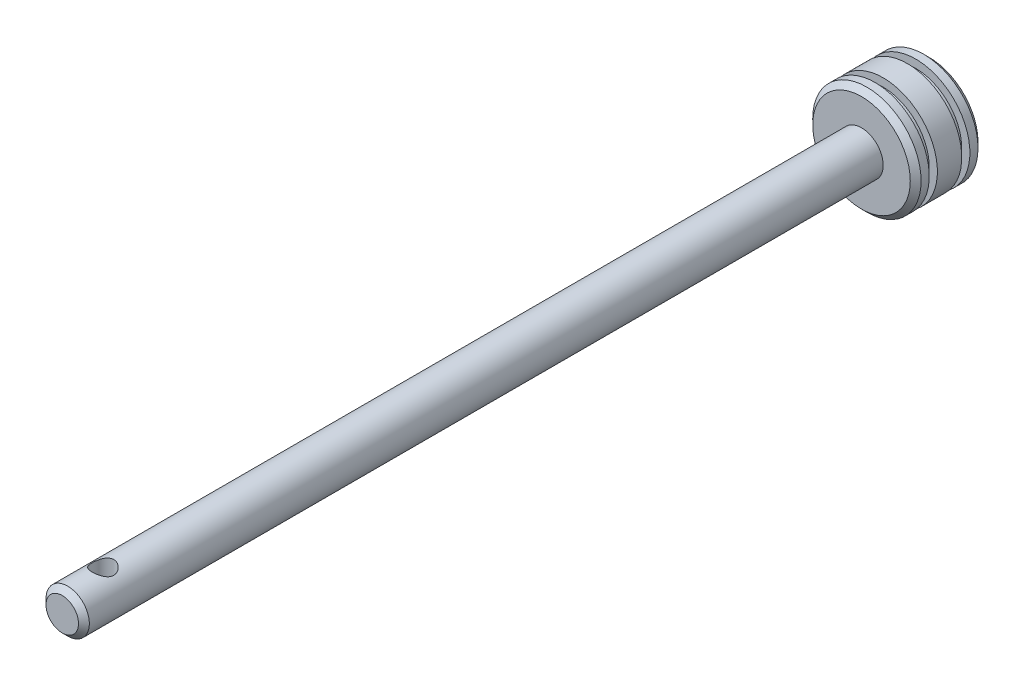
SolidWorks part; units mm, degrees
ref_plane "Plan1" through (0, 0, 0) normal (0, 0, 1) x (1, 0, 0)
ref_plane "Plan2" through (0, 0, 0) normal (0, 1, 0) x (1, 0, 0)
ref_plane "Plan3" through (0, 0, 0) normal (1, 0, 0) x (0, 0, -1)
sketch "Esquisse1" plane through (0, 0, 0) normal (0, 0, 1) x (1, 0, 0)
  circle A0 centre (0, 0) radius 20
  dimension "D1" = 40
extrude "Base-Extrusion" add sketch "Esquisse1" along normal blind 25
sketch "Esquisse2" plane through (0, 0, 25) normal (0, 0, 1) x (1, 0, 0)
  circle A0 centre (0, 0) radius 8
  circle A1 centre (0, 0) radius 20 construction
  dimension "D1" = 16
extrude "Boss.-Extru.1" add sketch "Esquisse2" along normal blind 295
chamfer "Chanfrein1" distance 2 angle 45 2 edges at (20, 0, 0) (20, 0, 25)
sketch "Esquisse3" plane through (0, 0, 0) normal (1, 0, 0) x (0, 0, -1)
  line L0 (-2, 20) -> (-23, 20) construction
  line L1 (-20, 20) -> (-17, 20)
  line L2 (-20, 20) -> (-20, 17)
  line L3 (-20, 17) -> (-17, 17)
  line L4 (-17, 20) -> (-17, 17)
  line L5 (-25, 18) -> (-25, -18) construction
  line L7 (-5, 17) -> (-8, 17)
  line L8 (-8, 20) -> (-8, 17)
  line L9 (-5, 20) -> (-5, 17)
  line L10 (-5, 20) -> (-8, 20)
  line L11 (0, -18) -> (0, 18) construction
  line L12 (0, 0) -> (-28.9503, 0) construction
  line L13 (-23, 0) -> (-2, 0) construction
  dimension "D1" = 3
  dimension "D2" = 3
  dimension "D3" = 5
  dimension "D4" = 3
  dimension "D6" = 5
revolve "Enlèvement de matière-Révolution2" cut sketch "Esquisse3" angle 360 about L12
chamfer "Chanfrein2" distance 2 angle 45 1 edges at (8, 0, 320)
sketch "Esquisse4" plane through (0, 0, 0) normal (0, 1, 0) x (1, 0, 0)
  line L0 (0, -23) -> (0, -20) construction
  line L1 (-6, -320) -> (6, -320) construction
  circle A0 centre (0, -305) radius 4
  dimension "D1" = 8
  dimension "D2" = 15
extrude "Enlèv. mat.-Extru.1" cut sketch "Esquisse4" against normal through all and the other way through all
sketch "Esq_WRNL_Compact001" plane through (0, 0, 0) normal (0, 0, 1) x (1, 0, 0)
  line L0 (-21, -21) -> (-21, 21)
  line L1 (21, -21) -> (21, 21)
  line L2 (-21, -21) -> (21, -21)
  line L3 (-21, 21) -> (21, 21)
